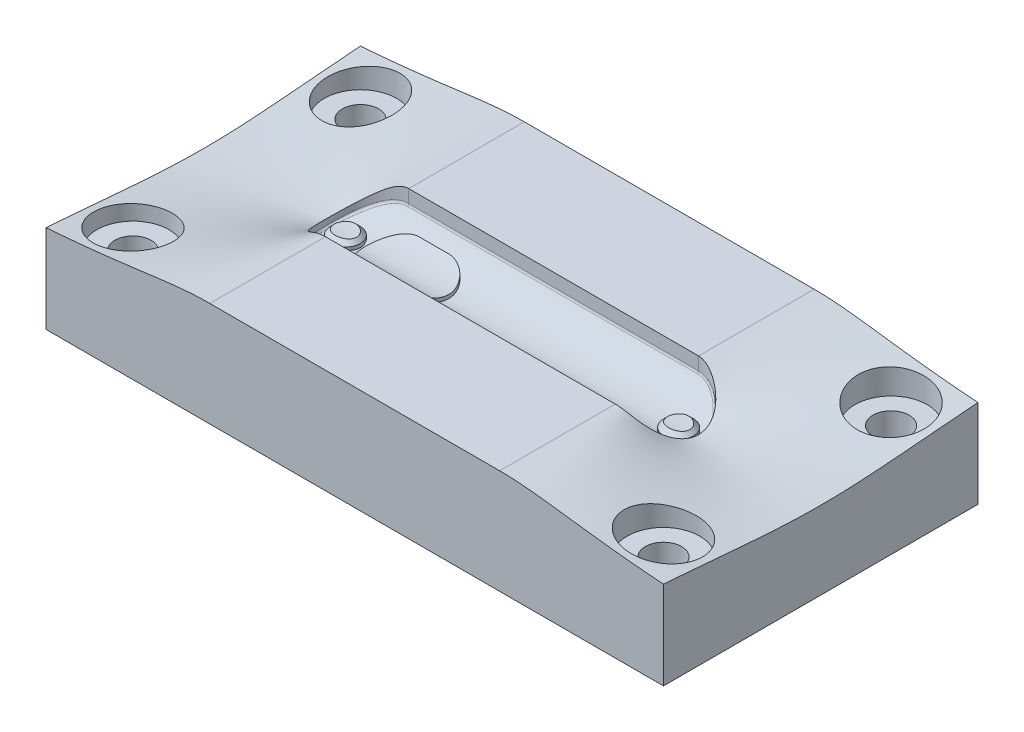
SolidWorks part; units mm, degrees
ref_plane "Front Plane" through (0, 0, 0) normal (0, 0, 1) x (1, 0, 0)
ref_plane "Top Plane" through (0, 0, 0) normal (0, 1, 0) x (1, 0, 0)
ref_plane "Right Plane" through (0, 0, 0) normal (1, 0, 0) x (0, 0, -1)
body saved out of another part "Stock-Handle Battery Cover-1"
sketch "Contain" plane through (0, -35, 0) normal (0, -1, 0) x (1, 0, 0)
  line L0 (-40, -11.5) -> (40, -11.5) construction
  line L1 (-40, 11.5) -> (40, 11.5) construction
  line L2 (-40, -11.5) -> (40, -11.5)
  line L3 (-40, 11.5) -> (40, 11.5)
  spline S0 degree 3 poles (1030.6733, -1677.3329) (65.4796, -89.5144) (-11.7659, 14.5932) (-41.6249, 11.3913) (-42.0188, 11.3279) (-43.1463, 11.0879) (-43.8336, 10.8656) (-45.8036, 10.0301) (-46.9382, 9.28) (-48.2163, 8.054) (-48.4642, 7.7937) (-48.9348, 7.2499) (-49.1588, 6.9655) (-49.5832, 6.369) (-49.7837, 6.057) (-50.1594, 5.4024) (-50.3354, 5.0577) (-50.8114, 3.9958) (-51.0591, 3.2466) (-51.3195, 2.0535) (-51.3864, 1.647) (-51.476, 0.8355) (-51.4994, 0.4277) (-51.5006, -0.3923) (-51.4778, -0.807) (-51.3881, -1.6287) (-51.3221, -2.0312) (-51.1516, -2.8209) (-51.0471, -3.2082) (-50.7997, -3.9681) (-50.6577, -4.3376) (-50.3417, -5.0448) (-50.1683, -5.385) (-49.7929, -6.0408) (-49.5896, -6.3581) (-48.948, -7.2613) (-48.4792, -7.8005) (-47.7192, -8.5316) (-47.4565, -8.7625) (-46.9111, -9.1995) (-46.6277, -9.406) (-45.7579, -9.9803) (-45.1488, -10.3072) (-44.1747, -10.7213) (-43.8398, -10.8464) (-43.1414, -11.0694) (-42.7774, -11.1671) (-42.0281, -11.3273) (-41.641, -11.3906) (-3.9122, -15.4434) (97.1397, 159.8266) (-1325.0547, 1511.0161) knots -2.275378 -2.275378 -2.275378 -2.275378 0.03125 0.03125 0.0625 0.0625 0.125 0.125 0.25 0.25 0.28125 0.28125 0.3125 0.3125 0.34375 0.34375 0.375 0.375 0.4375 0.4375 0.46875 0.46875 0.5 0.5 0.53125 0.53125 0.5625 0.5625 0.59375 0.59375 0.625 0.625 0.65625 0.65625 0.6875 0.6875 0.75 0.75 0.78125 0.78125 0.8125 0.8125 0.875 0.875 0.90625 0.90625 0.9375 0.9375 0.96875 0.96875 3.84783 3.84783 3.84783 3.84783 only from (-40, 11.5) to (-40, -11.5) construction
  spline S1 degree 3 poles (-1036.6934, 1673.578) (-65.8915, 90.1661) (11.6901, -14.6014) (41.6248, -11.3913) (42.0187, -11.3279) (43.1463, -11.0879) (43.8336, -10.8657) (45.1468, -10.3087) (45.7588, -9.9814) (46.9098, -9.2221) (47.4493, -8.7898) (48.2161, -8.0542) (48.4641, -7.7938) (48.9347, -7.2501) (49.1587, -6.9656) (49.5831, -6.3692) (49.7836, -6.0571) (50.1593, -5.4026) (50.3353, -5.0579) (50.8113, -3.996) (51.0591, -3.2468) (51.3195, -2.0538) (51.3864, -1.6472) (51.476, -0.8356) (51.4994, -0.4277) (51.5006, 0.3922) (51.4778, 0.8069) (51.3881, 1.6287) (51.3221, 2.0312) (51.1516, 2.821) (51.0471, 3.2082) (50.7997, 3.968) (50.6577, 4.3375) (50.3417, 5.0447) (50.1684, 5.3849) (49.7929, 6.0408) (49.5896, 6.3581) (48.9479, 7.2614) (48.4791, 7.8005) (47.7191, 8.5317) (47.4564, 8.7626) (46.9109, 9.1996) (46.6274, 9.4061) (45.7575, 9.9805) (45.1483, 10.3074) (44.1743, 10.7215) (43.8396, 10.8468) (43.1415, 11.0701) (42.7776, 11.1679) (42.0285, 11.3281) (41.6413, 11.3913) (1.6567, 15.6643) (-107.6832, -182.3616) (1426.0823, -1417.1044) knots -2.281373 -2.281373 -2.281373 -2.281373 0.03125 0.03125 0.0625 0.0625 0.125 0.125 0.1875 0.1875 0.25 0.25 0.28125 0.28125 0.3125 0.3125 0.34375 0.34375 0.375 0.375 0.4375 0.4375 0.46875 0.46875 0.5 0.5 0.53125 0.53125 0.5625 0.5625 0.59375 0.59375 0.625 0.625 0.65625 0.65625 0.6875 0.6875 0.75 0.75 0.78125 0.78125 0.8125 0.8125 0.875 0.875 0.90625 0.90625 0.9375 0.9375 0.96875 0.96875 4.020486 4.020486 4.020486 4.020486 only from (40, -11.5) to (40, 11.5) construction
  spline S2 degree 3 poles (-40, 11.5) (-40.4188, 11.5) (-40.8266, 11.4769) (-41.6249, 11.3913) (-42.0188, 11.3279) (-43.1463, 11.0879) (-43.8336, 10.8656) (-45.8036, 10.0301) (-46.9382, 9.28) (-48.2163, 8.054) (-48.4642, 7.7937) (-48.9348, 7.2499) (-49.1588, 6.9655) (-49.5832, 6.369) (-49.7837, 6.057) (-50.1594, 5.4024) (-50.3354, 5.0577) (-50.8114, 3.9958) (-51.0591, 3.2466) (-51.3195, 2.0535) (-51.3864, 1.647) (-51.476, 0.8355) (-51.4994, 0.4277) (-51.5006, -0.3923) (-51.4778, -0.807) (-51.3881, -1.6287) (-51.3221, -2.0312) (-51.1516, -2.8209) (-51.0471, -3.2082) (-50.7997, -3.9681) (-50.6577, -4.3376) (-50.3417, -5.0448) (-50.1683, -5.385) (-49.7929, -6.0408) (-49.5896, -6.3581) (-48.948, -7.2613) (-48.4792, -7.8005) (-47.7192, -8.5316) (-47.4565, -8.7625) (-46.9111, -9.1995) (-46.6277, -9.406) (-45.7579, -9.9803) (-45.1488, -10.3072) (-44.1747, -10.7213) (-43.8398, -10.8464) (-43.1414, -11.0694) (-42.7774, -11.1671) (-42.0281, -11.3273) (-41.641, -11.3906) (-40.8307, -11.4776) (-40.4181, -11.5) (-40, -11.5) knots 0 0 0 0 0.03125 0.03125 0.0625 0.0625 0.125 0.125 0.25 0.25 0.28125 0.28125 0.3125 0.3125 0.34375 0.34375 0.375 0.375 0.4375 0.4375 0.46875 0.46875 0.5 0.5 0.53125 0.53125 0.5625 0.5625 0.59375 0.59375 0.625 0.625 0.65625 0.65625 0.6875 0.6875 0.75 0.75 0.78125 0.78125 0.8125 0.8125 0.875 0.875 0.90625 0.90625 0.9375 0.9375 0.96875 0.96875 1 1 1 1
  spline S3 degree 3 poles (40, -11.5) (40.4187, -11.5) (40.8266, -11.4769) (41.6248, -11.3913) (42.0187, -11.3279) (43.1463, -11.0879) (43.8336, -10.8657) (45.1468, -10.3087) (45.7588, -9.9814) (46.9098, -9.2221) (47.4493, -8.7898) (48.2161, -8.0542) (48.4641, -7.7938) (48.9347, -7.2501) (49.1587, -6.9656) (49.5831, -6.3692) (49.7836, -6.0571) (50.1593, -5.4026) (50.3353, -5.0579) (50.8113, -3.996) (51.0591, -3.2468) (51.3195, -2.0538) (51.3864, -1.6472) (51.476, -0.8356) (51.4994, -0.4277) (51.5006, 0.3922) (51.4778, 0.8069) (51.3881, 1.6287) (51.3221, 2.0312) (51.1516, 2.821) (51.0471, 3.2082) (50.7997, 3.968) (50.6577, 4.3375) (50.3417, 5.0447) (50.1684, 5.3849) (49.7929, 6.0408) (49.5896, 6.3581) (48.9479, 7.2614) (48.4791, 7.8005) (47.7191, 8.5317) (47.4564, 8.7626) (46.9109, 9.1996) (46.6274, 9.4061) (45.7575, 9.9805) (45.1483, 10.3074) (44.1743, 10.7215) (43.8396, 10.8468) (43.1415, 11.0701) (42.7776, 11.1679) (42.0285, 11.3281) (41.6413, 11.3913) (40.8307, 11.4779) (40.4181, 11.5) (40, 11.5) knots 0 0 0 0 0.03125 0.03125 0.0625 0.0625 0.125 0.125 0.1875 0.1875 0.25 0.25 0.28125 0.28125 0.3125 0.3125 0.34375 0.34375 0.375 0.375 0.4375 0.4375 0.46875 0.46875 0.5 0.5 0.53125 0.53125 0.5625 0.5625 0.59375 0.59375 0.625 0.625 0.65625 0.65625 0.6875 0.6875 0.75 0.75 0.78125 0.78125 0.8125 0.8125 0.875 0.875 0.90625 0.90625 0.9375 0.9375 0.96875 0.96875 1 1 1 1
sketch "Split Line" plane through (0, -35, 0) normal (0, -1, 0) x (1, 0, 0)
  line L0 (-40, -11.5) -> (40, -11.5) construction
  line L1 (-40, 11.5) -> (40, 11.5) construction
  line L2 (-40, -11.5) -> (40, -11.5) construction
  line L3 (-40, 11.5) -> (40, 11.5) construction
  line L4 (-40, -24.2) -> (40, -24.2)
  line L5 (-40, 24.2) -> (40, 24.2)
  spline S0 degree 3 poles (1030.6733, -1677.3329) (65.4796, -89.5144) (-11.7659, 14.5932) (-41.6249, 11.3913) (-42.0188, 11.3279) (-43.1463, 11.0879) (-43.8336, 10.8656) (-45.8036, 10.0301) (-46.9382, 9.28) (-48.2163, 8.054) (-48.4642, 7.7937) (-48.9348, 7.2499) (-49.1588, 6.9655) (-49.5832, 6.369) (-49.7837, 6.057) (-50.1594, 5.4024) (-50.3354, 5.0577) (-50.8114, 3.9958) (-51.0591, 3.2466) (-51.3195, 2.0535) (-51.3864, 1.647) (-51.476, 0.8355) (-51.4994, 0.4277) (-51.5006, -0.3923) (-51.4778, -0.807) (-51.3881, -1.6287) (-51.3221, -2.0312) (-51.1516, -2.8209) (-51.0471, -3.2082) (-50.7997, -3.9681) (-50.6577, -4.3376) (-50.3417, -5.0448) (-50.1683, -5.385) (-49.7929, -6.0408) (-49.5896, -6.3581) (-48.948, -7.2613) (-48.4792, -7.8005) (-47.7192, -8.5316) (-47.4565, -8.7625) (-46.9111, -9.1995) (-46.6277, -9.406) (-45.7579, -9.9803) (-45.1488, -10.3072) (-44.1747, -10.7213) (-43.8398, -10.8464) (-43.1414, -11.0694) (-42.7774, -11.1671) (-42.0281, -11.3273) (-41.641, -11.3906) (-3.9122, -15.4434) (97.1397, 159.8266) (-1325.0547, 1511.0161) knots -2.275378 -2.275378 -2.275378 -2.275378 0.03125 0.03125 0.0625 0.0625 0.125 0.125 0.25 0.25 0.28125 0.28125 0.3125 0.3125 0.34375 0.34375 0.375 0.375 0.4375 0.4375 0.46875 0.46875 0.5 0.5 0.53125 0.53125 0.5625 0.5625 0.59375 0.59375 0.625 0.625 0.65625 0.65625 0.6875 0.6875 0.75 0.75 0.78125 0.78125 0.8125 0.8125 0.875 0.875 0.90625 0.90625 0.9375 0.9375 0.96875 0.96875 3.84783 3.84783 3.84783 3.84783 only from (-40, 11.5) to (-40, -11.5) construction
  spline S1 degree 3 poles (-1036.6934, 1673.578) (-65.8915, 90.1661) (11.6901, -14.6014) (41.6248, -11.3913) (42.0187, -11.3279) (43.1463, -11.0879) (43.8336, -10.8657) (45.1468, -10.3087) (45.7588, -9.9814) (46.9098, -9.2221) (47.4493, -8.7898) (48.2161, -8.0542) (48.4641, -7.7938) (48.9347, -7.2501) (49.1587, -6.9656) (49.5831, -6.3692) (49.7836, -6.0571) (50.1593, -5.4026) (50.3353, -5.0579) (50.8113, -3.996) (51.0591, -3.2468) (51.3195, -2.0538) (51.3864, -1.6472) (51.476, -0.8356) (51.4994, -0.4277) (51.5006, 0.3922) (51.4778, 0.8069) (51.3881, 1.6287) (51.3221, 2.0312) (51.1516, 2.821) (51.0471, 3.2082) (50.7997, 3.968) (50.6577, 4.3375) (50.3417, 5.0447) (50.1684, 5.3849) (49.7929, 6.0408) (49.5896, 6.3581) (48.9479, 7.2614) (48.4791, 7.8005) (47.7191, 8.5317) (47.4564, 8.7626) (46.9109, 9.1996) (46.6274, 9.4061) (45.7575, 9.9805) (45.1483, 10.3074) (44.1743, 10.7215) (43.8396, 10.8468) (43.1415, 11.0701) (42.7776, 11.1679) (42.0285, 11.3281) (41.6413, 11.3913) (1.6567, 15.6643) (-107.6832, -182.3616) (1426.0823, -1417.1044) knots -2.281373 -2.281373 -2.281373 -2.281373 0.03125 0.03125 0.0625 0.0625 0.125 0.125 0.1875 0.1875 0.25 0.25 0.28125 0.28125 0.3125 0.3125 0.34375 0.34375 0.375 0.375 0.4375 0.4375 0.46875 0.46875 0.5 0.5 0.53125 0.53125 0.5625 0.5625 0.59375 0.59375 0.625 0.625 0.65625 0.65625 0.6875 0.6875 0.75 0.75 0.78125 0.78125 0.8125 0.8125 0.875 0.875 0.90625 0.90625 0.9375 0.9375 0.96875 0.96875 4.020486 4.020486 4.020486 4.020486 only from (40, -11.5) to (40, 11.5) construction
  spline S2 degree 3 poles (-40, 11.5) (-40.4188, 11.5) (-40.8266, 11.4769) (-41.6249, 11.3913) (-42.0188, 11.3279) (-43.1463, 11.0879) (-43.8336, 10.8656) (-45.8036, 10.0301) (-46.9382, 9.28) (-48.2163, 8.054) (-48.4642, 7.7937) (-48.9348, 7.2499) (-49.1588, 6.9655) (-49.5832, 6.369) (-49.7837, 6.057) (-50.1594, 5.4024) (-50.3354, 5.0577) (-50.8114, 3.9958) (-51.0591, 3.2466) (-51.3195, 2.0535) (-51.3864, 1.647) (-51.476, 0.8355) (-51.4994, 0.4277) (-51.5006, -0.3923) (-51.4778, -0.807) (-51.3881, -1.6287) (-51.3221, -2.0312) (-51.1516, -2.8209) (-51.0471, -3.2082) (-50.7997, -3.9681) (-50.6577, -4.3376) (-50.3417, -5.0448) (-50.1683, -5.385) (-49.7929, -6.0408) (-49.5896, -6.3581) (-48.948, -7.2613) (-48.4792, -7.8005) (-47.7192, -8.5316) (-47.4565, -8.7625) (-46.9111, -9.1995) (-46.6277, -9.406) (-45.7579, -9.9803) (-45.1488, -10.3072) (-44.1747, -10.7213) (-43.8398, -10.8464) (-43.1414, -11.0694) (-42.7774, -11.1671) (-42.0281, -11.3273) (-41.641, -11.3906) (-40.8307, -11.4776) (-40.4181, -11.5) (-40, -11.5) knots 0 0 0 0 0.03125 0.03125 0.0625 0.0625 0.125 0.125 0.25 0.25 0.28125 0.28125 0.3125 0.3125 0.34375 0.34375 0.375 0.375 0.4375 0.4375 0.46875 0.46875 0.5 0.5 0.53125 0.53125 0.5625 0.5625 0.59375 0.59375 0.625 0.625 0.65625 0.65625 0.6875 0.6875 0.75 0.75 0.78125 0.78125 0.8125 0.8125 0.875 0.875 0.90625 0.90625 0.9375 0.9375 0.96875 0.96875 1 1 1 1 construction
  spline S3 degree 3 poles (40, -11.5) (40.4187, -11.5) (40.8266, -11.4769) (41.6248, -11.3913) (42.0187, -11.3279) (43.1463, -11.0879) (43.8336, -10.8657) (45.1468, -10.3087) (45.7588, -9.9814) (46.9098, -9.2221) (47.4493, -8.7898) (48.2161, -8.0542) (48.4641, -7.7938) (48.9347, -7.2501) (49.1587, -6.9656) (49.5831, -6.3692) (49.7836, -6.0571) (50.1593, -5.4026) (50.3353, -5.0579) (50.8113, -3.996) (51.0591, -3.2468) (51.3195, -2.0538) (51.3864, -1.6472) (51.476, -0.8356) (51.4994, -0.4277) (51.5006, 0.3922) (51.4778, 0.8069) (51.3881, 1.6287) (51.3221, 2.0312) (51.1516, 2.821) (51.0471, 3.2082) (50.7997, 3.968) (50.6577, 4.3375) (50.3417, 5.0447) (50.1684, 5.3849) (49.7929, 6.0408) (49.5896, 6.3581) (48.9479, 7.2614) (48.4791, 7.8005) (47.7191, 8.5317) (47.4564, 8.7626) (46.9109, 9.1996) (46.6274, 9.4061) (45.7575, 9.9805) (45.1483, 10.3074) (44.1743, 10.7215) (43.8396, 10.8468) (43.1415, 11.0701) (42.7776, 11.1679) (42.0285, 11.3281) (41.6413, 11.3913) (40.8307, 11.4779) (40.4181, 11.5) (40, 11.5) knots 0 0 0 0 0.03125 0.03125 0.0625 0.0625 0.125 0.125 0.1875 0.1875 0.25 0.25 0.28125 0.28125 0.3125 0.3125 0.34375 0.34375 0.375 0.375 0.4375 0.4375 0.46875 0.46875 0.5 0.5 0.53125 0.53125 0.5625 0.5625 0.59375 0.59375 0.625 0.625 0.65625 0.65625 0.6875 0.6875 0.75 0.75 0.78125 0.78125 0.8125 0.8125 0.875 0.875 0.90625 0.90625 0.9375 0.9375 0.96875 0.96875 1 1 1 1 construction
  spline S4 degree 1 poles (40, -24.2) (40, 24.2) knots 0 0 1 1 construction
  spline S5 degree 1 poles (-40, 24.2) (-40, -24.2) knots 0 0 1 1 construction
  spline S6 degree 3 poles (40, -24.2) (40.4371, -24.2) (41.3224, -24.1752) (43.0011, -24.0385) (45.0759, -23.7033) (47.3396, -23.0995) (49.4797, -22.3021) (51.4362, -21.3663) (53.348, -20.2316) (55.1387, -18.9238) (57.3065, -17.0236) (59.825, -14.1395) (61.8106, -10.7118) (63.0249, -7.5866) (63.8984, -4.3756) (64.2989, -0.9387) (64.1023, 2.6245) (63.689, 5.1234) (63.0467, 7.5188) (62.1218, 9.9176) (61.0355, 12.0418) (59.3238, 14.7162) (57.3425, 16.9875) (55.1504, 18.9146) (53.3503, 20.2266) (51.4614, 21.3523) (49.4868, 22.2984) (47.3963, 23.0814) (45.0873, 23.7039) (42.6089, 24.1063) (40.8631, 24.2) (40, 24.2) knots 0 0 0 0 0.015625 0.03125 0.0625 0.09375 0.125 0.15625 0.1875 0.21875 0.25 0.3125 0.375 0.40625 0.4375 0.5 0.53125 0.5625 0.59375 0.625 0.65625 0.6875 0.75 0.78125 0.8125 0.84375 0.875 0.90625 0.9375 0.96875 1 1 1 1
  spline S7 degree 3 poles (-40, 24.2) (-40.4373, 24.2) (-41.323, 24.1752) (-43.0008, 24.0385) (-45.0765, 23.7032) (-47.3394, 23.0996) (-49.481, 22.3013) (-51.4313, 21.3691) (-53.3483, 20.2324) (-55.1446, 18.9193) (-56.7602, 17.502) (-58.3275, 15.8595) (-60.2146, 13.4594) (-61.812, 10.7106) (-63.025, 7.5856) (-63.8984, 4.3754) (-64.2989, 0.9387) (-64.1023, -2.6246) (-63.689, -5.1233) (-63.0467, -7.5189) (-62.1217, -9.918) (-61.0356, -12.0417) (-59.324, -14.7161) (-57.3421, -16.9878) (-55.1516, -18.9136) (-53.3513, -20.2262) (-51.4597, -21.3529) (-48.8381, -22.6104) (-45.9124, -23.5667) (-42.619, -24.105) (-40.8653, -24.2) (-40, -24.2) knots 0 0 0 0 0.015625 0.03125 0.0625 0.09375 0.125 0.15625 0.1875 0.21875 0.25 0.28125 0.3125 0.375 0.40625 0.4375 0.5 0.53125 0.5625 0.59375 0.625 0.65625 0.6875 0.75 0.78125 0.8125 0.84375 0.875 0.9375 0.96875 1 1 1 1
  dimension "D1" = 12.7
